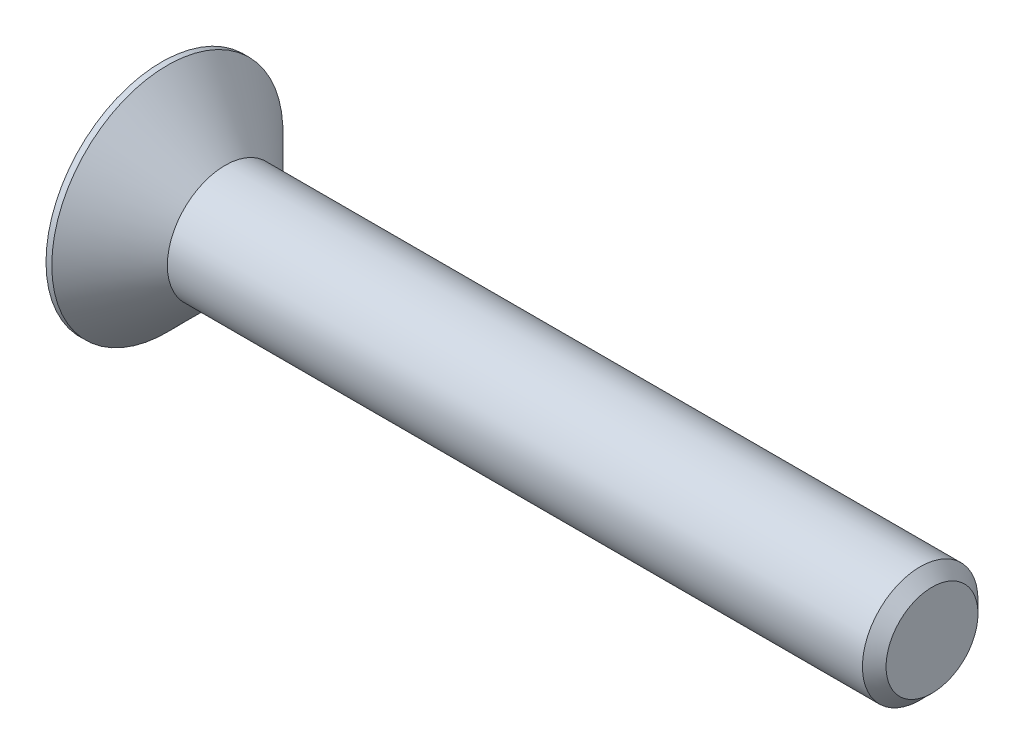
SolidWorks part; units mm, degrees
ref_plane "Plan de face" through (0, 0, 0) normal (0, 0, 1) x (1, 0, 0)
ref_plane "Plan de dessus" through (0, 0, 0) normal (0, 1, 0) x (1, 0, 0)
ref_plane "Plan de droite" through (0, 0, 0) normal (1, 0, 0) x (0, 0, -1)
imported_body "Importée3"
sketch "Esquisse1" plane through (-3, 0, 0) normal (-1, 0, 0) x (0, 0, 1)
  circle A0 centre (0, 0) radius 6
extrude "Boss.-Extru.1" add sketch "Esquisse1" along normal blind 0.3
sketch "Esquisse2" plane through (0, 0, 0) normal (1, 0, 0) x (0, 0, -1)
  circle A0 centre (0, 0) radius 3
extrude "Boss.-Extru.2" add sketch "Esquisse2" along normal blind 36.7
sketch "Esquisse3" plane through (0, 0, 0) normal (0, 0, 1) x (1, 0, 0)
  line L0 (-3.3, 2.7071) -> (-3.3, 0)
  line L1 (-3.3, 0) -> (-2.5929, 0)
  line L2 (-2.5929, 0) -> (-2.5929, 2)
  line L3 (-2.5929, 2) -> (-3.3, 2.7071)
  line L4 (-3.3, 0) -> (-2.5929, 0) construction
revolve "Enlèvement de matière-Révolution1" cut sketch "Esquisse3" angle 360 about L4
sketch "Esquisse4" plane through (0, 0, 0) normal (0, 0, 1) x (1, 0, 0)
  line L0 (-1, 2) -> (-1, 0)
  line L1 (-1, 0) -> (0.1547, 0)
  line L2 (0.1547, 0) -> (-1, 2)
  line L3 (-1, 0) -> (0.1547, 0) construction
revolve "Enlèvement de matière-Révolution2" cut sketch "Esquisse4" angle 360 about L3
chamfer "Chanfrein1" distance 0.6135 angle 45 1 edges at (36.7, 0, -3)
other "Bloquer***"
